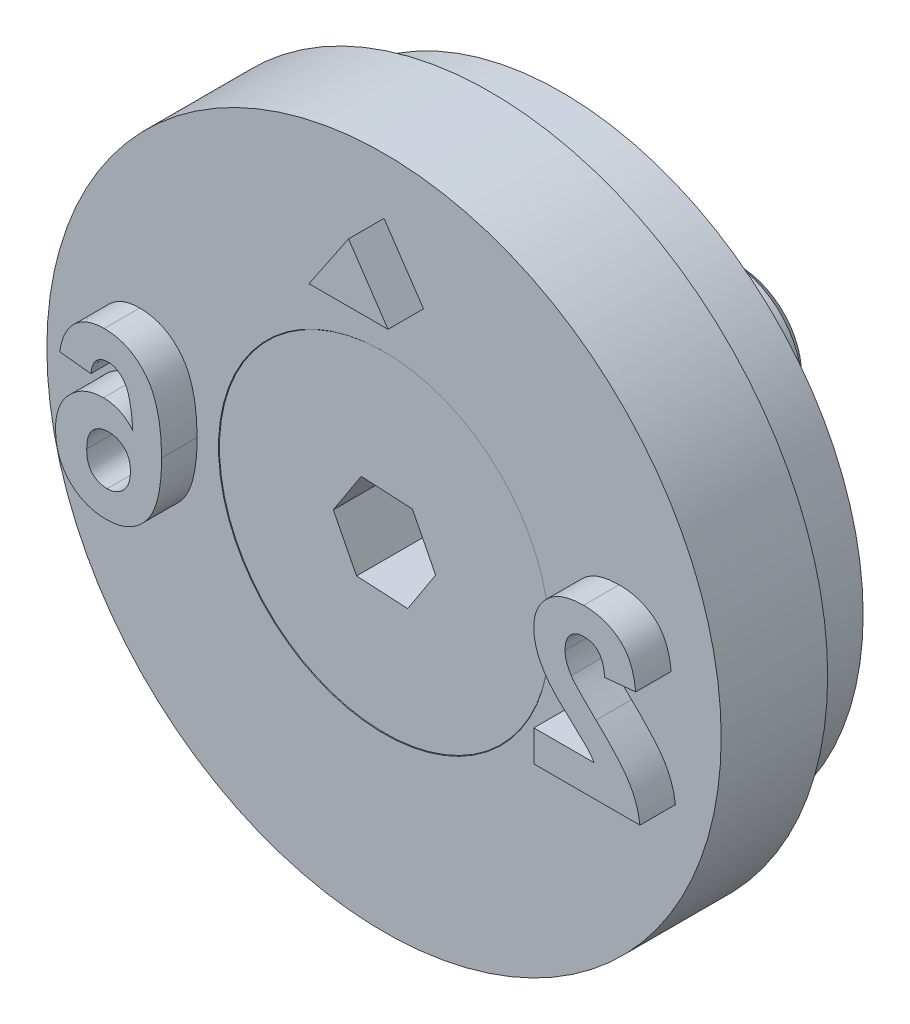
SolidWorks part; units mm, degrees
other "<M4 X .7 FHCS>-<Imported1>"
ref_plane "Front Plane" through (0, 0, 0) normal (0, 0, 1) x (1, 0, 0)
ref_plane "Top Plane" through (0, 0, 0) normal (0, 1, 0) x (1, 0, 0)
ref_plane "Right Plane" through (0, 0, 0) normal (1, 0, 0) x (0, 0, -1)
imported_body "Imported1"
other "DeleteFace1"
sketch "Sketch1" plane through (0, 0, 0) normal (0, 0, 1) x (1, 0, 0)
  line L0 (0, 7.9145) -> (-1.1129, 6.2645)
  line L1 (-1.1129, 6.2645) -> (1.1129, 6.2645)
  line L2 (1.1129, 6.2645) -> (0, 7.9145)
  text T0 "2      6" font "Arial" height 4.572
  dimension "D1" = 2.286
extrude "Boss-Extrude1" add sketch "Sketch1" along normal blind 1
inserted part "M4 X .7 FHCS"
move or copy body "Body-Move/Copy2" placed by mates yes
